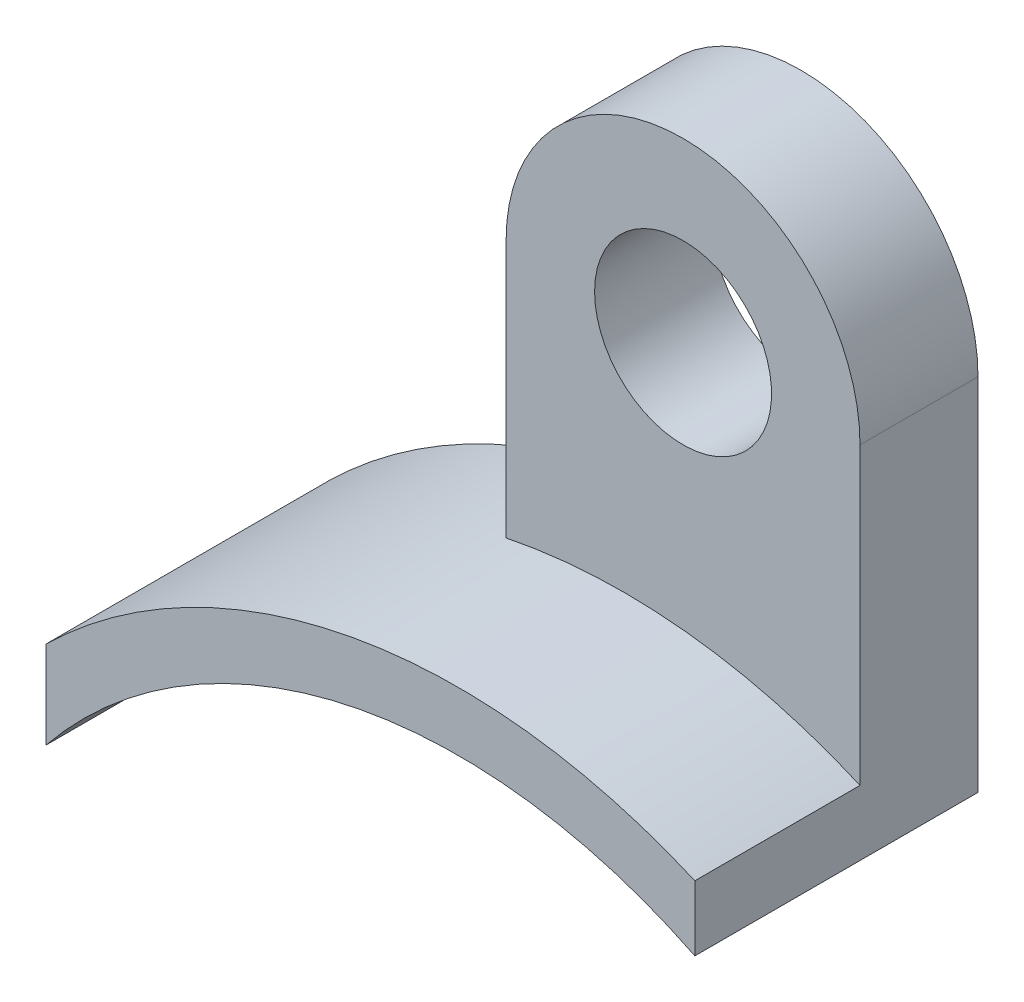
SolidWorks part; units mm, degrees
ref_plane "前视基准面" through (0, 0, 0) normal (0, 0, 1) x (1, 0, 0)
ref_plane "上视基准面" through (0, 0, 0) normal (0, 1, 0) x (1, 0, 0)
ref_plane "右视基准面" through (0, 0, 0) normal (1, 0, 0) x (0, 0, -1)
sketch "草图1" plane through (0, 0, 0) normal (0, 0, 1) x (1, 0, 0)
  line L0 (-35, 35.7071) -> (-35, 28.2843)
  line L1 (20, 45.8258) -> (20, 40.3113)
  arc A0 (20, 40.3113) -> (-35, 28.2843) centre (0, 0) ccw
  arc A1 (20, 45.8258) -> (-35, 35.7071) centre (0, 0) ccw
  dimension "D1" = 90
  dimension "D2" = 100
  dimension "D3" = 20
  dimension "D4" = 35
extrude "拉伸1" add sketch "草图1" along normal blind 24
sketch "草图2" plane through (0, 0, 0) normal (0, 0, -1) x (-1, 0, 0)
  line L0 (-20, 45.8258) -> (-20, 70.8258)
  line L1 (10, 70.8258) -> (10, 48.9898)
  arc A0 (-20, 70.8258) -> (10, 70.8258) centre (-5, 70.8258) cw
  arc A1 (35, 35.7071) -> (-20, 45.8258) centre (0, 0) ccw construction
  circle A2 centre (-5, 70.8258) radius 7.5
  arc A3 (10, 48.9898) -> (-20, 45.8258) centre (0, 0) ccw
  dimension "D1" = 15
  dimension "D3" = 15
  dimension "D2" = 25
extrude "拉伸2" add sketch "草图2" against normal blind 10
